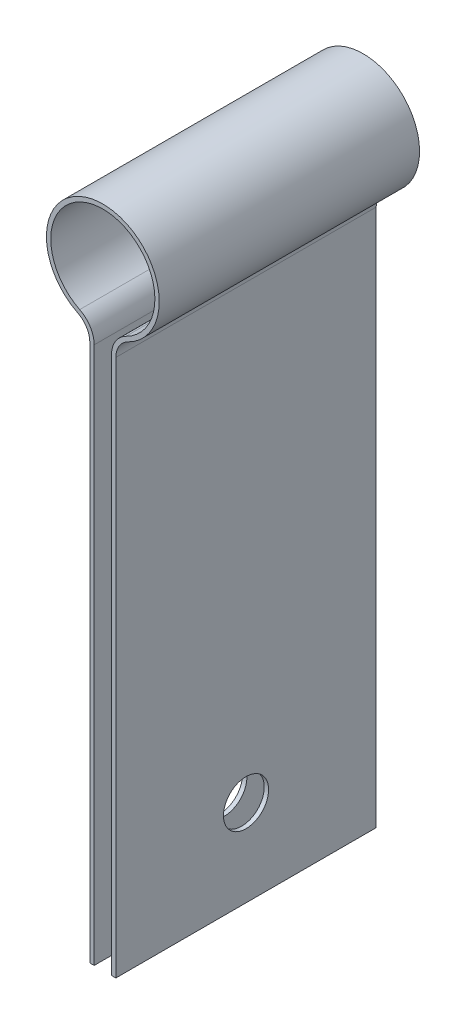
SolidWorks part; units mm, degrees
ref_plane "Plan1" through (0, 0, 0) normal (0, 0, 1) x (1, 0, 0)
ref_plane "Plan2" through (0, 0, 0) normal (0, 1, 0) x (1, 0, 0)
ref_plane "Plan3" through (0, 0, 0) normal (1, 0, 0) x (0, 0, -1)
sketch "Esquisse1" plane through (0, 0, 0) normal (0, 0, 1) x (1, 0, 0)
  line L0 (-1, -8.0623) -> (-1, -70)
  line L1 (0, 0) -> (0, -40) construction
  line L2 (1, -8.0623) -> (1, -70)
  line L3 (-1.5, -8.0623) -> (-1.5, -70)
  line L4 (1.5, -8.0623) -> (1.5, -70)
  line L5 (-1.5, -70) -> (-1, -70)
  line L6 (1, -70) -> (1.5, -70)
  arc A0 (1, -8.0623) -> (2.6667, -5.3748) centre (4, -8.0623) cw
  arc A1 (2.6667, -5.3748) -> (-2.6667, -5.3748) centre (0, 0) ccw
  arc A2 (-1, -8.0623) -> (-2.6667, -5.3748) centre (-4, -8.0623) ccw
  arc A3 (-1.5, -8.0623) -> (-2.8889, -5.8227) centre (-4, -8.0623) ccw
  arc A4 (2.8889, -5.8227) -> (-2.8889, -5.8227) centre (0, 0) ccw
  arc A5 (1.5, -8.0623) -> (2.8889, -5.8227) centre (4, -8.0623) cw
  point P9 (1, -5.9161)
  point P12 (-1, -5.9161)
  dimension "D1" = 12
  dimension "D3" = 3
  dimension "D2" = 70
  dimension "D4" = 2
  dimension "D5" = 0.5
extrude "Base-Extrusion" add sketch "Esquisse1" along normal mid plane 30
sketch "Esquisse2" plane through (-1.5, 0, 0) normal (-1, 0, 0) x (0, 0, 1)
  line L0 (-15, -8.0623) -> (-15, -70) construction
  line L1 (15, -70) -> (-15, -70) construction
  circle A0 centre (0, -60) radius 2.6
  dimension "D3" = 5.2
  dimension "D1" = 15
  dimension "D2" = 10
extrude "Enlèv. mat.-Extru.1" cut sketch "Esquisse2" against normal through all
